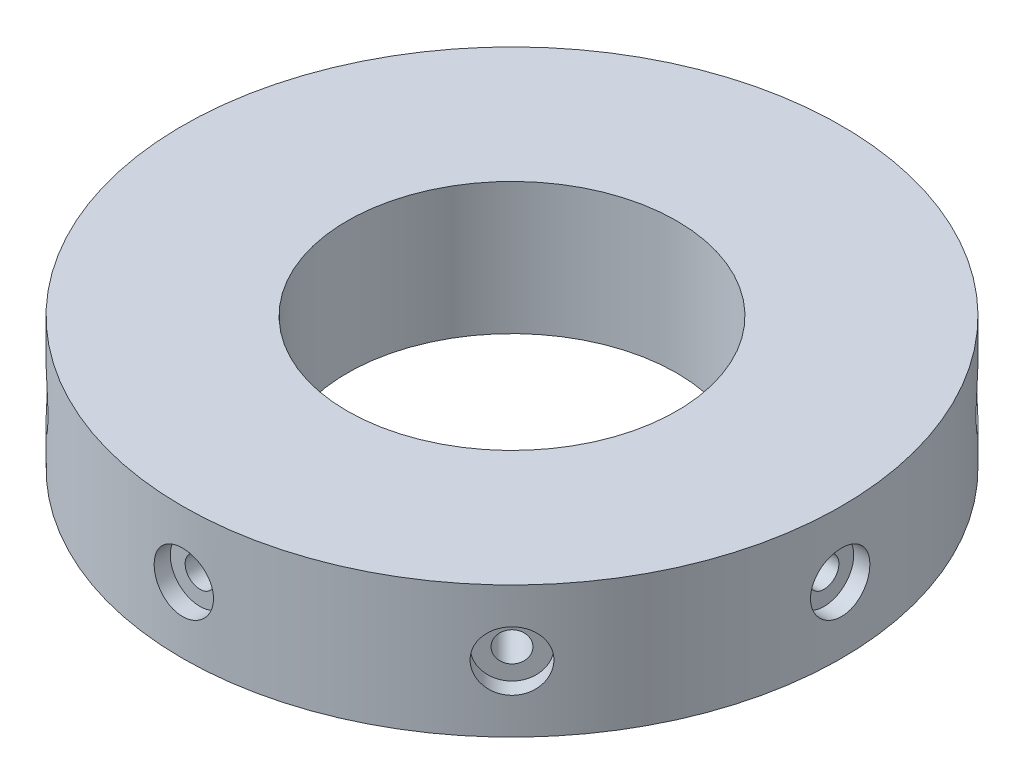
SolidWorks part; units mm, degrees
ref_plane "Front Plane" through (0, 0, 0) normal (0, 0, 1) x (1, 0, 0)
ref_plane "Top Plane" through (0, 0, 0) normal (0, 1, 0) x (1, 0, 0)
ref_plane "Right Plane" through (0, 0, 0) normal (1, 0, 0) x (0, 0, -1)
sketch "Sketch1" plane through (0, 0, 0) normal (0, 1, 0) x (1, 0, 0)
  circle A0 centre (0, 0) radius 100
  circle A1 centre (0, 0) radius 50
  dimension "D1" = 200
  dimension "D2" = 100
extrude "Boss-Extrude1" add sketch "Sketch1" along normal blind 40
ref_plane "Plane1" through (0, 0, 100) normal (0, 0, 1) x (1, 0, 0)
hole_wizard "CBORE for M8 Hex Head Bolt1" positions "Sketch3" profile "Sketch2" counterbore size "M8" standard "ISO"
sketch "Sketch3" plane through (0, 0, 100) normal (0, 0, 1) x (1, 0, 0)
  line L0 (-100, 20) -> (100, 20) construction
  line L1 (-100, 40) -> (-100, 0) construction
  line L2 (100, 0) -> (100, 40) construction
  point P0 (0, 20)
sketch "Sketch2" plane through (0, 20, 100) normal (1, 0, 0) x (0, -1, 0)
  line L0 (0, 0) -> (0, 27.7039)
  line L1 (0, 27.7039) -> (4.5, 25)
  line L2 (4.5, 25) -> (4.5, 5.3)
  line L3 (4.5, 5.3) -> (9.0055, 5.3)
  line L4 (9.0055, 5.3) -> (9.0055, 0)
  line L5 (9.0055, 0) -> (0, 0)
  line L10 (0, 27.7039) -> (-4.5, 25) construction
  line L11 (0, -6.35) -> (0, 107.95) construction
  dimension "Hole Dia." = 9
  dimension "Hole Depth" = 25
  dimension "C'Bore Dia." = 18.011
  dimension "C'Bore Depth" = 5.3
  dimension "Drill Angle" = 118
pattern_circular "CirPattern1" count 8 over 360 about axis through (0, 0, 0) along (0, 1, 0) of "CBORE for M8 Hex Head Bolt1"
